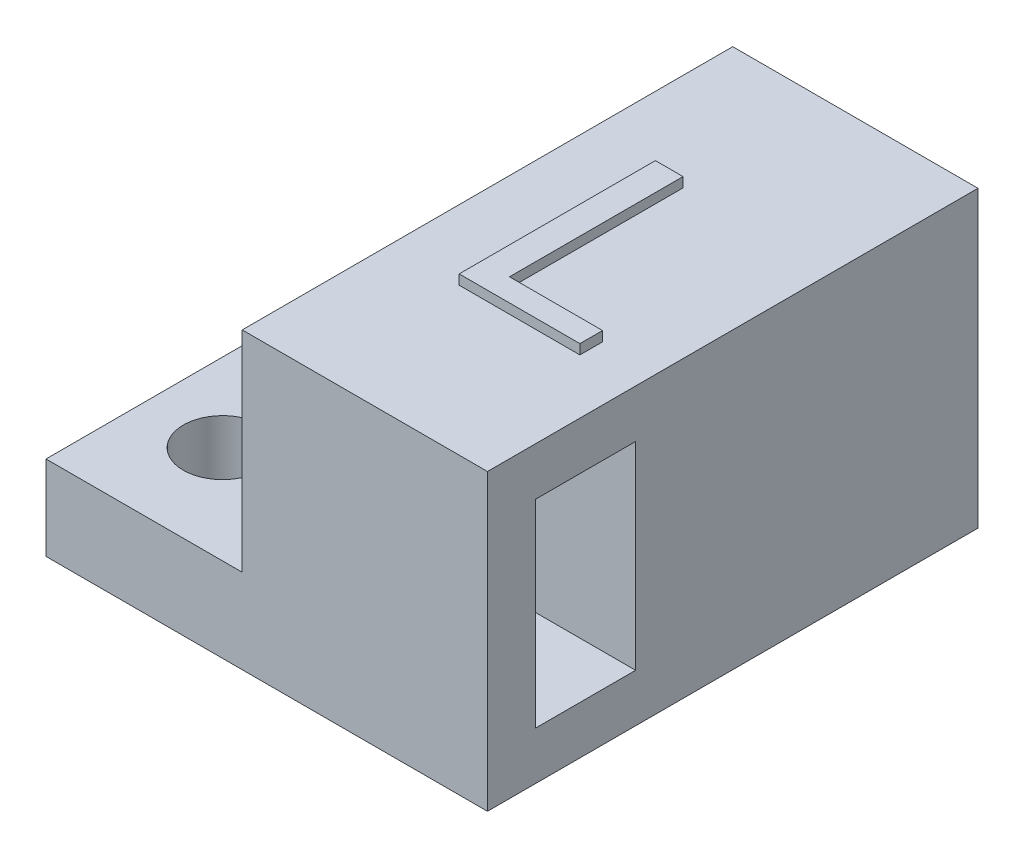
SolidWorks part; units mm, degrees
ref_plane "Спереди" through (0, 0, 0) normal (0, 0, 1) x (1, 0, 0)
ref_plane "Сверху" through (0, 0, 0) normal (0, 1, 0) x (1, 0, 0)
ref_plane "Справа" through (0, 0, 0) normal (1, 0, 0) x (0, 0, -1)
sketch "Sketch1" plane through (0, 0, 0) normal (0, 1, 0) x (1, 0, 0)
  line L1 (12.5, -25) -> (-12.5, -25)
  line L2 (12.5, -25) -> (12.5, 25)
  line L3 (12.5, 25) -> (-12.5, 25)
  line L4 (-12.5, -25) -> (-12.5, 25)
  line L5 (12.5, -25) -> (-12.5, 25) construction
  line L6 (12.5, 25) -> (-12.5, -25) construction
  point P0 (0, 0)
  dimension "D1" = 25
  dimension "D2" = 50
extrude "Boss-Extrude1" add sketch "Sketch1" along normal blind 30
sketch "Sketch2" plane through (-12.5, 0, 0) normal (-1, 0, 0) x (0, 0, 1)
  line L0 (-25, 4.3025) -> (25, 4.3025) construction
  line L1 (-25, 30) -> (-25, 0) construction
  line L2 (25, 30) -> (25, 0) construction
  line L4 (25, 8.605) -> (-25, 8.605)
  line L5 (25, 8.605) -> (25, 0)
  line L6 (25, 0) -> (-25, 0)
  line L7 (-25, 8.605) -> (-25, 0)
  line L8 (25, 8.605) -> (-25, 0) construction
  line L9 (25, 0) -> (-25, 8.605) construction
  point P6 (0, 4.3025)
extrude "Boss-Extrude2" add sketch "Sketch2" along normal blind 20
sketch "Sketch3" plane through (0, 8.605, 0) normal (0, 1, 0) x (1, 0, 0)
  line L0 (-24.5, -25) -> (-24.5, 25) construction
  line L1 (-32.5, 25) -> (-12.5, 25) construction
  line L2 (-32.5, -25) -> (-12.5, -25) construction
  circle A0 centre (-24.5, 15) radius 4
  circle A1 centre (-24.5, -15) radius 4
  dimension "D1" = 8
  dimension "D2" = 8
  dimension "D3" = 10
  dimension "D4" = 10
extrude "Cut-Extrude1" cut sketch "Sketch3" against normal through all
sketch "Sketch4" plane through (12.5, 0, 0) normal (1, 0, 0) x (0, 0, -1)
  line L0 (-15, 30) -> (-15, 0) construction
  line L3 (-25, 30) -> (25, 30) construction
  line L4 (-9.9, 4.9) -> (-20.1, 4.9)
  line L5 (-9.9, 4.9) -> (-9.9, 25.1)
  line L6 (-9.9, 25.1) -> (-20.1, 25.1)
  line L7 (-20.1, 4.9) -> (-20.1, 25.1)
  line L8 (-9.9, 4.9) -> (-20.1, 25.1) construction
  line L9 (-9.9, 25.1) -> (-20.1, 4.9) construction
  line L10 (-25, 0) -> (25, 0) construction
  point P6 (-15, 15)
  point P13 (-15, 15)
  dimension "D1" = 20.2
  dimension "D2" = 10.2
  dimension "D3" = 10
extrude "Cut-Extrude2" cut sketch "Sketch4" against normal blind 20
sketch "Sketch5" plane through (0, 30, 0) normal (0, 1, 0) x (1, 0, 0)
  line L0 (12.5, -10) -> (-12.5, -10) construction
  line L1 (12.5, -25) -> (12.5, 25) construction
  line L2 (-12.5, 25) -> (-12.5, -25) construction
  text T0 "L" font "Arial" height 20
  dimension "D1" = 15
extrude "Boss-Extrude3" add sketch "Sketch5" along normal blind 1
